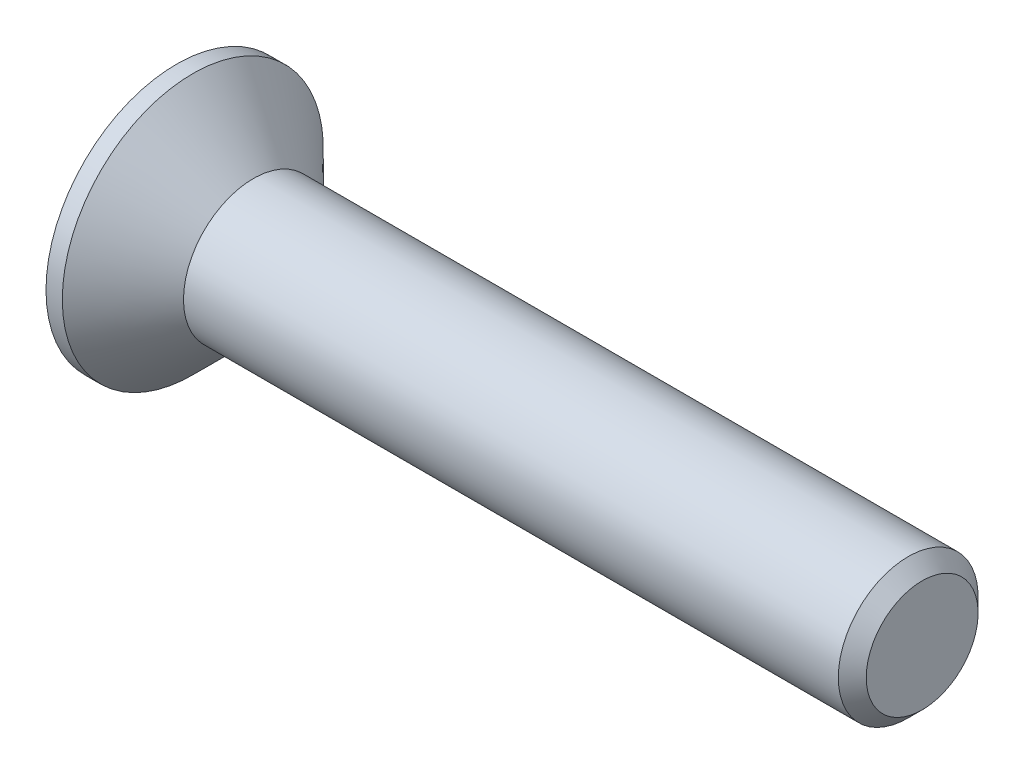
SolidWorks part; units mm, degrees
ref_plane "Front Plane" through (0, 0, 0) normal (0, 0, 1) x (1, 0, 0)
ref_plane "Top Plane" through (0, 0, 0) normal (0, 1, 0) x (1, 0, 0)
ref_plane "Right Plane" through (0, 0, 0) normal (1, 0, 0) x (0, 0, -1)
sketch "Sketch1" plane through (0, 0, 0) normal (0, 0, 1) x (1, 0, 0)
  line L1 (-1.65, 2.8) -> (-1.65, 0)
  line L2 (-1.65, 0) -> (14.35, 0)
  line L3 (14.35, 0) -> (14.35, 1.5)
  line L4 (14.35, 1.5) -> (0, 1.5)
  line L5 (-1.65, 2.8) -> (-1.3, 2.8)
  line L6 (-1.3, 2.8) -> (0, 1.5)
  dimension "D1" = 1.5
  dimension "D2" = 45
  dimension "D3" = 1.65
  dimension "D4" = 16
  dimension "D5" = 2.8
revolve "Revolve1" add sketch "Sketch1" angle 360 about L2
chamfer "Chamfer1" distance 0.3 angle 45 1 edges at (14.35, 0, 1.5)
sketch "Sketch2" plane through (-1.65, 0, 0) normal (-1, 0, 0) x (0, 0, 1)
  line L0 (-0.365, 1.45) -> (0.365, 1.45)
  line L1 (0.365, 1.45) -> (0.365, 0.365)
  line L2 (0.365, 0.365) -> (1.45, 0.365)
  line L3 (1.45, 0.365) -> (1.45, -0.365)
  line L4 (1.45, -0.365) -> (0.365, -0.365)
  line L5 (0.365, -0.365) -> (0.365, -1.45)
  line L6 (0.365, -1.45) -> (-0.365, -1.45)
  line L7 (-0.365, -1.45) -> (-0.365, -0.365)
  line L8 (-0.365, -0.365) -> (-1.45, -0.365)
  line L9 (-1.45, -0.365) -> (-1.45, 0.365)
  line L10 (-1.45, 0.365) -> (-0.365, 0.365)
  line L11 (-0.365, 0.365) -> (-0.365, 1.45)
  point P2 (0, 1.45)
  point P14 (0, -1.45)
  point P15 (1.45, 0)
  point P16 (-1.45, 0)
  dimension "D1" = 2.9
  dimension "D2" = 0.73
extrude "Cut-Extrude1" cut sketch "Sketch2" against normal blind 1.25
